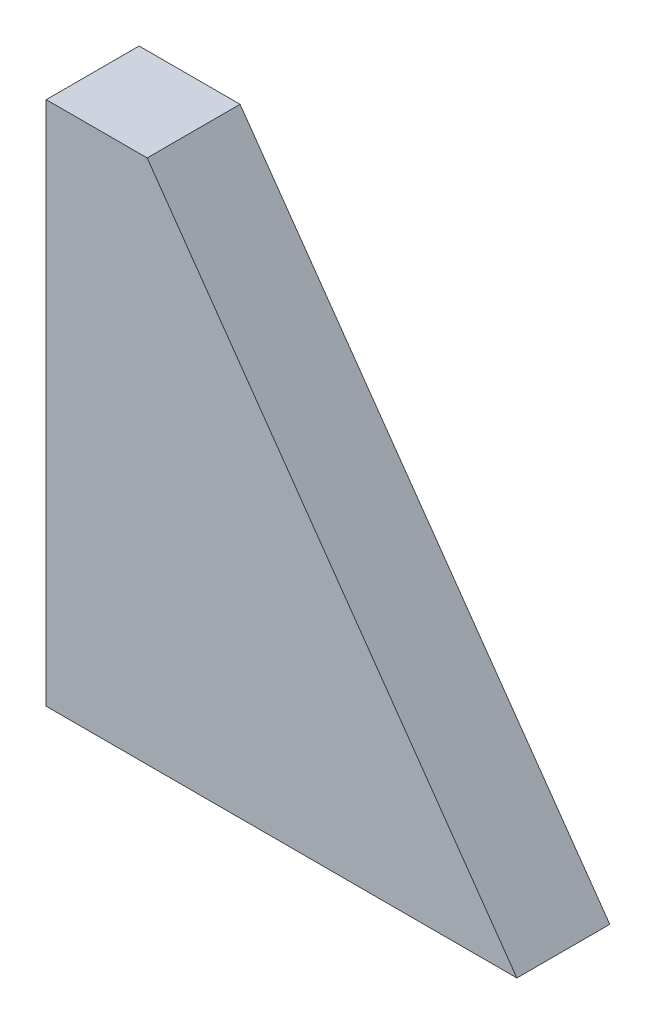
SolidWorks part; units mm, degrees
ref_plane "Ebene vorne" through (0, 0, 0) normal (0, 0, 1) x (1, 0, 0)
ref_plane "Ebene oben" through (0, 0, 0) normal (0, 1, 0) x (1, 0, 0)
ref_plane "Ebene rechts" through (0, 0, 0) normal (1, 0, 0) x (0, 0, -1)
sketch "Skizze1" plane through (0, 0, 0) normal (0, 0, 1) x (1, 0, 0)
  line L0 (0, 56.546) -> (0, 0)
  line L1 (0, 0) -> (50.6582, 0)
  line L2 (50.6582, 0) -> (10.8651, 56.546)
  line L3 (10.8651, 56.546) -> (0, 56.546)
  line L4 (-28.1826, 69.7762) -> (-28.1826, 0) construction
  line L5 (-28.1826, 66.58) -> (13.8587, 66.58)
  line L6 (13.8587, 66.58) -> (13.8587, 43.293)
  line L7 (13.8587, 43.293) -> (0, 43.293)
  line L8 (0, 43.293) -> (0, 15.5922)
  line L9 (0, 15.5922) -> (13.8587, 15.5922)
  line L10 (13.8587, 15.5922) -> (13.8587, 0)
  line L11 (13.8587, 0) -> (-29.4002, 0)
extrude "Linear austragen1" add sketch "Skizze1" along normal mid plane 10 contours L3 L0 L1 L2
equation "\"LÄNGE\"=0"
equation "\"BREITE\"=0"
equation "\"HÖHE\"=0"
equation "\"DURCHMESSER\"=0"
equation "\"Stückzahl\"= 1"
